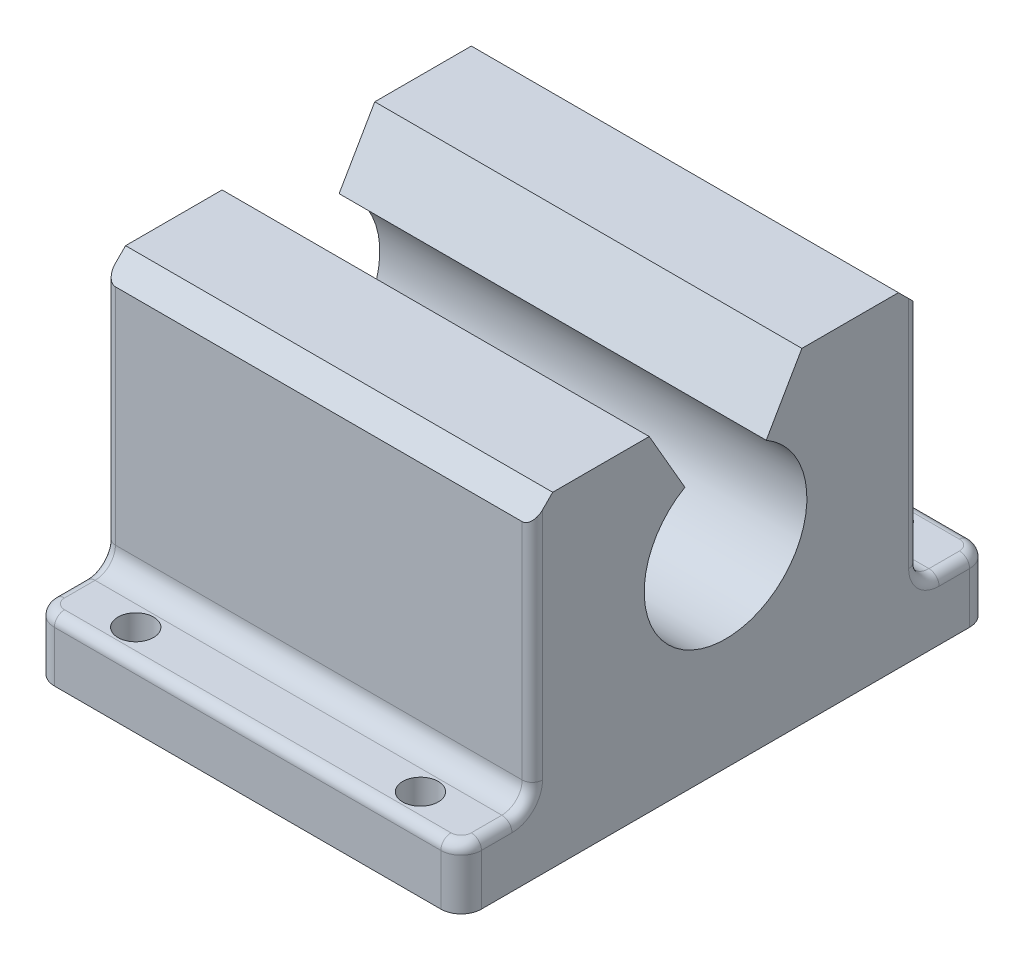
SolidWorks part; units mm, degrees
ref_plane "front" through (0, 0, 0) normal (0, 0, 1) x (1, 0, 0)
ref_plane "top" through (0, 0, 0) normal (0, 1, 0) x (1, 0, 0)
ref_plane "side" through (0, 0, 0) normal (1, 0, 0) x (0, 0, -1)
sketch "Sketch1" plane through (0, 0, 0) normal (1, 0, 0) x (0, 0, -1)
  line L0 (0, 0) -> (0, 82.55) construction
  line L1 (-41.275, 0) -> (41.275, 0)
  line L2 (41.275, 0) -> (41.275, 9.525)
  line L3 (41.275, 9.525) -> (30.1625, 9.525)
  line L4 (30.1625, 9.525) -> (30.1625, 50.8)
  line L5 (-30.1625, 50.8) -> (30.1625, 50.8)
  line L7 (-30.1625, 9.525) -> (-30.1625, 50.8)
  line L8 (-41.275, 9.525) -> (-30.1625, 9.525)
  line L9 (-41.275, 0) -> (-41.275, 9.525)
  circle A1 centre (0, 30.1625) radius 12.7
  point P14 (0, 0)
  dimension "D2" = 30.1625
  dimension "D3" = 25.4
  dimension "D1" = 82.55
  dimension "D4" = 50.8
  dimension "D7" = 9.525
extrude "Base-Extrude" add sketch "Sketch1" along normal blind 66.675
sketch "Sketch2" plane through (0, 9.525, 0) normal (0, 1, 0) x (-1, 0, 0)
  line L0 (-66.675, 41.275) -> (-66.675, 30.1625) construction
  line L1 (-66.675, 41.275) -> (0, 41.275) construction
  circle A0 centre (-55.5625, 36.5125) radius 2.7781
  dimension "D1" = 5.5562
  dimension "D2" = 11.1125
  dimension "D3" = 4.7625
extrude "Cut-Extrude1" cut sketch "Sketch2" against normal through all
pattern_linear "LPattern1" count 2 spacing 44.45 along (-1, 0, 0) count 2 spacing 73.025 along (0, 0, -1) of "Cut-Extrude1"
sketch "Sketch3" plane through (66.675, 0, 0) normal (1, 0, 0) x (0, 0, -1)
  line L0 (0, 30.1625) -> (0, 55.5587) construction
  line L1 (11.9151, 50.8) -> (-11.9151, 50.8)
  line L2 (-30.1625, 50.8) -> (30.1625, 50.8) construction
  line L3 (11.9151, 50.8) -> (0, 30.1625)
  line L4 (-11.9151, 50.8) -> (0, 30.1625)
  point P8 (0, 50.8)
  dimension "D1" = 60
extrude "Cut-Extrude2" cut sketch "Sketch3" against normal through all
chamfer "Chamfer1" distance 3.175 angle 45 2 edges at (33.3375, 50.8, 30.1625) (33.3375, 50.8, -30.1625)
fillet "Fillet1" radius 3.175 6 edges at (33.3375, 9.525, 30.1625) (33.3375, 9.525, -30.1625) (66.675, 4.7625, 41.275) (66.675, 4.7625, -41.275) (0, 4.7625, 41.275) (0, 4.7625, -41.275)
fillet "Fillet2" radius 1.5875 18 edges at (0, 30.1625, -30.1625) (66.675, 30.1625, -30.1625) (0, 9.525, -35.7188) (66.675, 9.525, -35.7188) (33.3375, 9.525, -41.275) (65.7451, 9.525, -40.3451) (0.9299, 9.525, -40.3451) (0, 9.525, 35.7188) (33.3375, 9.525, 41.275) (66.675, 9.525, 35.7188) (65.7451, 9.525, 40.3451) (0.9299, 9.525, 40.3451) (66.675, 30.1625, 30.1625) (0, 30.1625, 30.1625) (0, 10.4549, -31.0924) (66.675, 10.4549, -31.0924) (0, 10.4549, 31.0924) (66.675, 10.4549, 31.0924)
